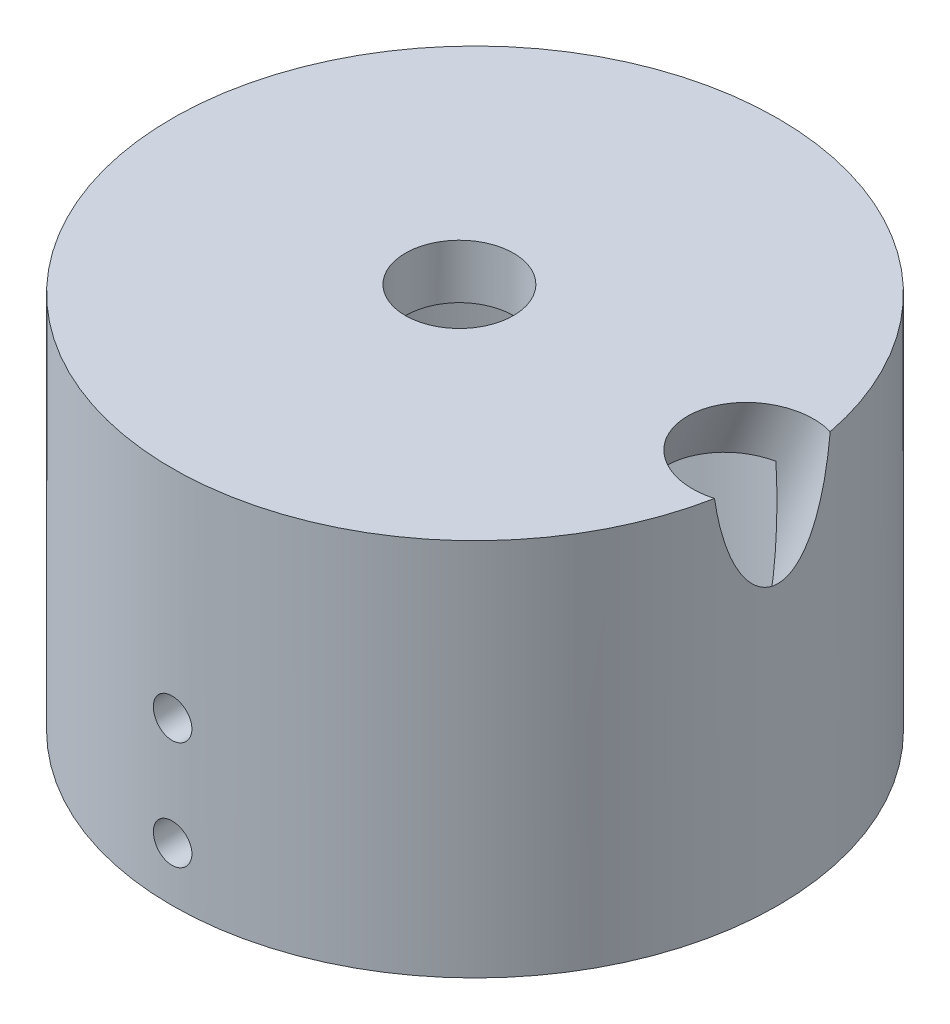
SolidWorks part; units mm, degrees
ref_plane "Front Plane" through (0, 0, 0) normal (0, 0, 1) x (1, 0, 0)
ref_plane "Top Plane" through (0, 0, 0) normal (0, 1, 0) x (1, 0, 0)
ref_plane "Right Plane" through (0, 0, 0) normal (1, 0, 0) x (0, 0, -1)
sketch "Sketch1" plane through (0, 0, 0) normal (0, 0, 1) x (1, 0, 0)
  line L0 (0, 0) -> (0, 88.5934) construction
  line L1 (0, 22.225) -> (17.78, 22.225)
  line L2 (17.78, 22.225) -> (17.78, 0)
  line L3 (17.78, 0) -> (14.605, 0)
  line L4 (14.605, 0) -> (14.605, 19.05)
  line L5 (14.605, 19.05) -> (0, 19.05)
  line L6 (0, 19.05) -> (0, 22.225)
  dimension "D1" = 3.175
  dimension "D2" = 3.175
  dimension "D3" = 14.605
  dimension "D4" = 19.05
revolve "Revolve1" add sketch "Sketch1" angle 360 about L0
sketch "Sketch2" plane through (0, 22.225, 0) normal (0, 1, 0) x (1, 0, 0)
  circle A0 centre (-0.9144, 0) radius 3.175
  point P0 (-0.9144, 0)
  dimension "D1" = 0.9144
extrude "Cut-Extrude1" cut sketch "Sketch2" against normal through all
sketch "Sketch3" plane through (0, 0, 0) normal (1, 0, 0) x (0, 0, -1)
  line L0 (-17.78, 0) -> (17.78, 0) construction
  line L1 (0, -18.1483) -> (-13.2257, -18.1483) construction
  point P0 (0, -18.1483)
  dimension "D1" = 18.1483
ref_plane "Plane1" through (-6.3034, -15.6015, 0) normal (0.3746, 0.9272, 0) x (-0.9272, 0.3746, 0)
sketch "Sketch4" plane through (-6.3034, -15.6015, 0) normal (0.3746, 0.9272, 0) x (-0.9272, 0.3746, 0)
  circle A0 centre (-6.7985, 0) radius 3.556
  dimension "D1" = 7.112
extrude "Cut-Extrude2" cut sketch "Sketch4" along normal through all
sketch "Sketch5" plane through (0, 0, 0) normal (0, 0, 1) x (1, 0, 0)
  line L0 (0, 0) -> (0, 20.9355) construction
  line L1 (-17.78, 0) -> (17.78, 0) construction
  circle A0 centre (0, 3.175) radius 1.1303
  circle A1 centre (0, 9.525) radius 1.1303
  dimension "D3" = 2.2606
  dimension "D1" = 6.35
  dimension "D2" = 3.175
extrude "Cut-Extrude3" cut sketch "Sketch5" along normal through all
